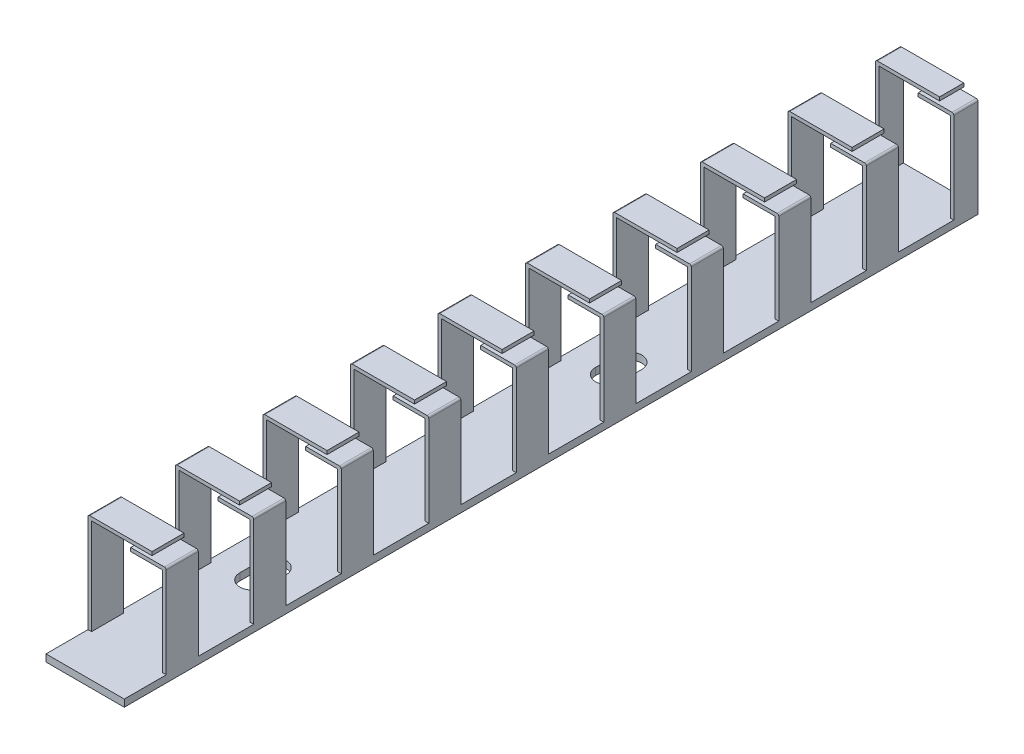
SolidWorks part; units mm, degrees
ref_plane "Plan de face" through (0, 0, 0) normal (0, 0, 1) x (1, 0, 0)
ref_plane "Plan de dessus" through (0, 0, 0) normal (0, 1, 0) x (1, 0, 0)
ref_plane "Plan de droite" through (0, 0, 0) normal (1, 0, 0) x (0, 0, -1)
sketch "Esquisse1" plane through (0, 0, 0) normal (0, 0, 1) x (1, 0, 0)
  line L0 (0, 0) -> (0, 14.75)
  line L1 (0.25, 15) -> (9, 15)
  line L2 (0, 0) -> (11, 0)
  line L3 (11, 0) -> (11, 13.75)
  line L4 (10.75, 14) -> (6, 14)
  line L5 (10.5, 13.5) -> (6, 13.5)
  line L6 (10.5, 1) -> (10.5, 13.5)
  line L7 (0.5, 1) -> (10.5, 1)
  line L8 (0.5, 1) -> (0.5, 14.5)
  line L9 (0.5, 14.5) -> (9, 14.5)
  line L10 (9, 15) -> (9, 14.5)
  line L11 (6, 14) -> (6, 13.5)
  line L12 (11, 0) -> (11, 14) construction
  line L13 (10.5, 0.5) -> (10.5, 13.5) construction
  line L14 (0.5, 0.5) -> (0.5, 14.5) construction
  line L15 (11, 14) -> (6, 14) construction
  line L16 (0, 0) -> (0, 15) construction
  line L17 (0, 15) -> (9, 15) construction
  line L24 (0.5, 0.5) -> (10.5, 0.5) construction
  arc A0 (11, 13.75) -> (10.75, 14) centre (10.75, 13.75) ccw
  arc A1 (0, 14.75) -> (0.25, 15) centre (0.25, 14.75) cw
  point P19 (11, 14)
  point P23 (0, 15)
  dimension "D5" = 0.25
  dimension "D1" = 11
  dimension "D2" = 15
  dimension "D3" = 14
  dimension "D4" = 1
extrude "Boss.-Extru.1" add sketch "Esquisse1" along normal blind 250
sketch "Esquisse2" plane through (11, 0, 0) normal (1, 0, 0) x (0, 0, -1)
  line L0 (-250, 0) -> (0, 0) construction
  line L1 (-128.9, 1) -> (-121.1, 1)
  line L2 (-128.9, 1) -> (-128.9, 17)
  line L3 (-128.9, 17) -> (-121.1, 17)
  line L4 (-121.1, 1) -> (-121.1, 17)
  line L5 (-116.6, 1) -> (-108.8, 1)
  line L6 (-116.6, 1) -> (-116.6, 17)
  line L7 (-116.6, 17) -> (-108.8, 17)
  line L8 (-108.8, 1) -> (-108.8, 17)
  line L9 (-104.3, 1) -> (-96.5, 1)
  line L10 (-104.3, 1) -> (-104.3, 17)
  line L11 (-104.3, 17) -> (-96.5, 17)
  line L12 (-96.5, 1) -> (-96.5, 17)
  line L13 (-92, 1) -> (-84.2, 1)
  line L14 (-92, 1) -> (-92, 17)
  line L15 (-92, 17) -> (-84.2, 17)
  line L16 (-84.2, 1) -> (-84.2, 17)
  line L17 (-79.7, 1) -> (-71.9, 1)
  line L18 (-79.7, 1) -> (-79.7, 17)
  line L19 (-79.7, 17) -> (-71.9, 17)
  line L20 (-71.9, 1) -> (-71.9, 17)
  line L21 (-67.4, 1) -> (-59.6, 1)
  line L22 (-67.4, 1) -> (-67.4, 17)
  line L23 (-67.4, 17) -> (-59.6, 17)
  line L24 (-59.6, 1) -> (-59.6, 17)
  line L25 (-55.1, 1) -> (-47.3, 1)
  line L26 (-55.1, 1) -> (-55.1, 17)
  line L27 (-55.1, 17) -> (-47.3, 17)
  line L28 (-47.3, 1) -> (-47.3, 17)
  line L29 (-42.8, 1) -> (-35, 1)
  line L30 (-42.8, 1) -> (-42.8, 17)
  line L31 (-42.8, 17) -> (-35, 17)
  line L32 (-35, 1) -> (-35, 17)
  line L33 (-30.5, 1) -> (-22.7, 1)
  line L34 (-30.5, 1) -> (-30.5, 17)
  line L35 (-30.5, 17) -> (-22.7, 17)
  line L36 (-22.7, 1) -> (-22.7, 17)
  line L37 (-18.2, 1) -> (-10.4, 1)
  line L38 (-18.2, 1) -> (-18.2, 17)
  line L39 (-18.2, 17) -> (-10.4, 17)
  line L40 (-10.4, 1) -> (-10.4, 17)
  line L41 (-5.9, 1) -> (1.9, 1)
  line L42 (-5.9, 1) -> (-5.9, 17)
  line L43 (-5.9, 17) -> (1.9, 17)
  line L44 (1.9, 1) -> (1.9, 17)
  line L45 (-128.9, 1) -> (-121.1, 1)
  line L46 (-128.9, 1) -> (-128.9, 17)
  line L47 (-128.9, 17) -> (-121.1, 17)
  line L48 (-121.1, 1) -> (-121.1, 17)
  line L49 (-116.6, 1) -> (-108.8, 1)
  line L50 (-116.6, 1) -> (-116.6, 17)
  line L51 (-116.6, 17) -> (-108.8, 17)
  line L52 (-108.8, 1) -> (-108.8, 17)
  line L53 (-104.3, 1) -> (-96.5, 1)
  line L54 (-104.3, 1) -> (-104.3, 17)
  line L55 (-104.3, 17) -> (-96.5, 17)
  line L56 (-96.5, 1) -> (-96.5, 17)
  line L57 (-92, 1) -> (-84.2, 1)
  line L58 (-92, 1) -> (-92, 17)
  line L59 (-92, 17) -> (-84.2, 17)
  line L60 (-84.2, 1) -> (-84.2, 17)
  line L61 (-79.7, 1) -> (-71.9, 1)
  line L62 (-79.7, 1) -> (-79.7, 17)
  line L63 (-79.7, 17) -> (-71.9, 17)
  line L64 (-71.9, 1) -> (-71.9, 17)
  line L65 (-67.4, 1) -> (-59.6, 1)
  line L66 (-67.4, 1) -> (-67.4, 17)
  line L67 (-67.4, 17) -> (-59.6, 17)
  line L68 (-59.6, 1) -> (-59.6, 17)
  line L69 (-55.1, 1) -> (-47.3, 1)
  line L70 (-55.1, 1) -> (-55.1, 17)
  line L71 (-55.1, 17) -> (-47.3, 17)
  line L72 (-47.3, 1) -> (-47.3, 17)
  line L73 (-42.8, 1) -> (-35, 1)
  line L74 (-42.8, 1) -> (-42.8, 17)
  line L75 (-42.8, 17) -> (-35, 17)
  line L76 (-35, 1) -> (-35, 17)
  line L77 (-30.5, 1) -> (-22.7, 1)
  line L78 (-30.5, 1) -> (-30.5, 17)
  line L79 (-30.5, 17) -> (-22.7, 17)
  line L80 (-22.7, 1) -> (-22.7, 17)
  line L81 (-18.2, 1) -> (-10.4, 1)
  line L82 (-18.2, 1) -> (-18.2, 17)
  line L83 (-18.2, 17) -> (-10.4, 17)
  line L84 (-10.4, 1) -> (-10.4, 17)
  line L85 (-141.2, 1) -> (-133.4, 1)
  line L86 (-141.2, 1) -> (-141.2, 17)
  line L87 (-141.2, 17) -> (-133.4, 17)
  line L88 (-133.4, 1) -> (-133.4, 17)
  line L89 (-128.9, 1) -> (-121.1, 1)
  line L90 (-128.9, 1) -> (-128.9, 17)
  line L91 (-128.9, 17) -> (-121.1, 17)
  line L92 (-121.1, 1) -> (-121.1, 17)
  line L93 (-116.6, 1) -> (-108.8, 1)
  line L94 (-116.6, 1) -> (-116.6, 17)
  line L95 (-116.6, 17) -> (-108.8, 17)
  line L96 (-108.8, 1) -> (-108.8, 17)
  line L97 (-104.3, 1) -> (-96.5, 1)
  line L98 (-104.3, 1) -> (-104.3, 17)
  line L99 (-104.3, 17) -> (-96.5, 17)
  line L100 (-96.5, 1) -> (-96.5, 17)
  line L101 (-92, 1) -> (-84.2, 1)
  line L102 (-92, 1) -> (-92, 17)
  line L103 (-92, 17) -> (-84.2, 17)
  line L104 (-84.2, 1) -> (-84.2, 17)
  line L105 (-79.7, 1) -> (-71.9, 1)
  line L106 (-79.7, 1) -> (-79.7, 17)
  line L107 (-79.7, 17) -> (-71.9, 17)
  line L108 (-71.9, 1) -> (-71.9, 17)
  line L109 (-67.4, 1) -> (-59.6, 1)
  line L110 (-67.4, 1) -> (-67.4, 17)
  line L111 (-67.4, 17) -> (-59.6, 17)
  line L112 (-59.6, 1) -> (-59.6, 17)
  line L113 (-55.1, 1) -> (-47.3, 1)
  line L114 (-55.1, 1) -> (-55.1, 17)
  line L115 (-55.1, 17) -> (-47.3, 17)
  line L116 (-47.3, 1) -> (-47.3, 17)
  line L117 (-42.8, 1) -> (-35, 1)
  line L118 (-42.8, 1) -> (-42.8, 17)
  line L119 (-42.8, 17) -> (-35, 17)
  line L120 (-35, 1) -> (-35, 17)
  line L121 (-30.5, 1) -> (-22.7, 1)
  line L122 (-30.5, 1) -> (-30.5, 17)
  line L123 (-30.5, 17) -> (-22.7, 17)
  line L124 (-22.7, 1) -> (-22.7, 17)
  line L125 (-153.5, 1) -> (-145.7, 1)
  line L126 (-153.5, 1) -> (-153.5, 17)
  line L127 (-153.5, 17) -> (-145.7, 17)
  line L128 (-145.7, 1) -> (-145.7, 17)
  line L129 (-141.2, 1) -> (-133.4, 1)
  line L130 (-141.2, 1) -> (-141.2, 17)
  line L131 (-141.2, 17) -> (-133.4, 17)
  line L132 (-133.4, 1) -> (-133.4, 17)
  line L133 (-128.9, 1) -> (-121.1, 1)
  line L134 (-128.9, 1) -> (-128.9, 17)
  line L135 (-128.9, 17) -> (-121.1, 17)
  line L136 (-121.1, 1) -> (-121.1, 17)
  line L137 (-116.6, 1) -> (-108.8, 1)
  line L138 (-116.6, 1) -> (-116.6, 17)
  line L139 (-116.6, 17) -> (-108.8, 17)
  line L140 (-108.8, 1) -> (-108.8, 17)
  line L141 (-104.3, 1) -> (-96.5, 1)
  line L142 (-104.3, 1) -> (-104.3, 17)
  line L143 (-104.3, 17) -> (-96.5, 17)
  line L144 (-96.5, 1) -> (-96.5, 17)
  line L145 (-92, 1) -> (-84.2, 1)
  line L146 (-92, 1) -> (-92, 17)
  line L147 (-92, 17) -> (-84.2, 17)
  line L148 (-84.2, 1) -> (-84.2, 17)
  line L149 (-79.7, 1) -> (-71.9, 1)
  line L150 (-79.7, 1) -> (-79.7, 17)
  line L151 (-79.7, 17) -> (-71.9, 17)
  line L152 (-71.9, 1) -> (-71.9, 17)
  line L153 (-67.4, 1) -> (-59.6, 1)
  line L154 (-67.4, 1) -> (-67.4, 17)
  line L155 (-67.4, 17) -> (-59.6, 17)
  line L156 (-59.6, 1) -> (-59.6, 17)
  line L157 (-55.1, 1) -> (-47.3, 1)
  line L158 (-55.1, 1) -> (-55.1, 17)
  line L159 (-55.1, 17) -> (-47.3, 17)
  line L160 (-47.3, 1) -> (-47.3, 17)
  line L161 (-42.8, 1) -> (-35, 1)
  line L162 (-42.8, 1) -> (-42.8, 17)
  line L163 (-42.8, 17) -> (-35, 17)
  line L164 (-35, 1) -> (-35, 17)
  line L165 (-165.8, 1) -> (-158, 1)
  line L166 (-165.8, 1) -> (-165.8, 17)
  line L167 (-165.8, 17) -> (-158, 17)
  line L168 (-158, 1) -> (-158, 17)
  line L169 (-153.5, 1) -> (-145.7, 1)
  line L170 (-153.5, 1) -> (-153.5, 17)
  line L171 (-153.5, 17) -> (-145.7, 17)
  line L172 (-145.7, 1) -> (-145.7, 17)
  line L173 (-141.2, 1) -> (-133.4, 1)
  line L174 (-141.2, 1) -> (-141.2, 17)
  line L175 (-141.2, 17) -> (-133.4, 17)
  line L176 (-133.4, 1) -> (-133.4, 17)
  line L177 (-128.9, 1) -> (-121.1, 1)
  line L178 (-128.9, 1) -> (-128.9, 17)
  line L179 (-128.9, 17) -> (-121.1, 17)
  line L180 (-121.1, 1) -> (-121.1, 17)
  line L181 (-116.6, 1) -> (-108.8, 1)
  line L182 (-116.6, 1) -> (-116.6, 17)
  line L183 (-116.6, 17) -> (-108.8, 17)
  line L184 (-108.8, 1) -> (-108.8, 17)
  line L185 (-104.3, 1) -> (-96.5, 1)
  line L186 (-104.3, 1) -> (-104.3, 17)
  line L187 (-104.3, 17) -> (-96.5, 17)
  line L188 (-96.5, 1) -> (-96.5, 17)
  line L189 (-92, 1) -> (-84.2, 1)
  line L190 (-92, 1) -> (-92, 17)
  line L191 (-92, 17) -> (-84.2, 17)
  line L192 (-84.2, 1) -> (-84.2, 17)
  line L193 (-79.7, 1) -> (-71.9, 1)
  line L194 (-79.7, 1) -> (-79.7, 17)
  line L195 (-79.7, 17) -> (-71.9, 17)
  line L196 (-71.9, 1) -> (-71.9, 17)
  line L197 (-67.4, 1) -> (-59.6, 1)
  line L198 (-67.4, 1) -> (-67.4, 17)
  line L199 (-67.4, 17) -> (-59.6, 17)
  line L200 (-59.6, 1) -> (-59.6, 17)
  line L201 (-55.1, 1) -> (-47.3, 1)
  line L202 (-55.1, 1) -> (-55.1, 17)
  line L203 (-55.1, 17) -> (-47.3, 17)
  line L204 (-47.3, 1) -> (-47.3, 17)
  line L205 (-178.1, 1) -> (-170.3, 1)
  line L206 (-178.1, 1) -> (-178.1, 17)
  line L207 (-178.1, 17) -> (-170.3, 17)
  line L208 (-170.3, 1) -> (-170.3, 17)
  line L209 (-165.8, 1) -> (-158, 1)
  line L210 (-165.8, 1) -> (-165.8, 17)
  line L211 (-165.8, 17) -> (-158, 17)
  line L212 (-158, 1) -> (-158, 17)
  line L213 (-153.5, 1) -> (-145.7, 1)
  line L214 (-153.5, 1) -> (-153.5, 17)
  line L215 (-153.5, 17) -> (-145.7, 17)
  line L216 (-145.7, 1) -> (-145.7, 17)
  line L217 (-141.2, 1) -> (-133.4, 1)
  line L218 (-141.2, 1) -> (-141.2, 17)
  line L219 (-141.2, 17) -> (-133.4, 17)
  line L220 (-133.4, 1) -> (-133.4, 17)
  line L221 (-128.9, 1) -> (-121.1, 1)
  line L222 (-128.9, 1) -> (-128.9, 17)
  line L223 (-128.9, 17) -> (-121.1, 17)
  line L224 (-121.1, 1) -> (-121.1, 17)
  line L225 (-116.6, 1) -> (-108.8, 1)
  line L226 (-116.6, 1) -> (-116.6, 17)
  line L227 (-116.6, 17) -> (-108.8, 17)
  line L228 (-108.8, 1) -> (-108.8, 17)
  line L229 (-104.3, 1) -> (-96.5, 1)
  line L230 (-104.3, 1) -> (-104.3, 17)
  line L231 (-104.3, 17) -> (-96.5, 17)
  line L232 (-96.5, 1) -> (-96.5, 17)
  line L233 (-92, 1) -> (-84.2, 1)
  line L234 (-92, 1) -> (-92, 17)
  line L235 (-92, 17) -> (-84.2, 17)
  line L236 (-84.2, 1) -> (-84.2, 17)
  line L237 (-79.7, 1) -> (-71.9, 1)
  line L238 (-79.7, 1) -> (-79.7, 17)
  line L239 (-79.7, 17) -> (-71.9, 17)
  line L240 (-71.9, 1) -> (-71.9, 17)
  line L241 (-67.4, 1) -> (-59.6, 1)
  line L242 (-67.4, 1) -> (-67.4, 17)
  line L243 (-67.4, 17) -> (-59.6, 17)
  line L244 (-59.6, 1) -> (-59.6, 17)
  line L245 (-190.4, 1) -> (-182.6, 1)
  line L246 (-190.4, 1) -> (-190.4, 17)
  line L247 (-190.4, 17) -> (-182.6, 17)
  line L248 (-182.6, 1) -> (-182.6, 17)
  line L249 (-178.1, 1) -> (-170.3, 1)
  line L250 (-178.1, 1) -> (-178.1, 17)
  line L251 (-178.1, 17) -> (-170.3, 17)
  line L252 (-170.3, 1) -> (-170.3, 17)
  line L253 (-165.8, 1) -> (-158, 1)
  line L254 (-165.8, 1) -> (-165.8, 17)
  line L255 (-165.8, 17) -> (-158, 17)
  line L256 (-158, 1) -> (-158, 17)
  line L257 (-153.5, 1) -> (-145.7, 1)
  line L258 (-153.5, 1) -> (-153.5, 17)
  line L259 (-153.5, 17) -> (-145.7, 17)
  line L260 (-145.7, 1) -> (-145.7, 17)
  line L261 (-141.2, 1) -> (-133.4, 1)
  line L262 (-141.2, 1) -> (-141.2, 17)
  line L263 (-141.2, 17) -> (-133.4, 17)
  line L264 (-133.4, 1) -> (-133.4, 17)
  line L265 (-128.9, 1) -> (-121.1, 1)
  line L266 (-128.9, 1) -> (-128.9, 17)
  line L267 (-128.9, 17) -> (-121.1, 17)
  line L268 (-121.1, 1) -> (-121.1, 17)
  line L269 (-116.6, 1) -> (-108.8, 1)
  line L270 (-116.6, 1) -> (-116.6, 17)
  line L271 (-116.6, 17) -> (-108.8, 17)
  line L272 (-108.8, 1) -> (-108.8, 17)
  line L273 (-104.3, 1) -> (-96.5, 1)
  line L274 (-104.3, 1) -> (-104.3, 17)
  line L275 (-104.3, 17) -> (-96.5, 17)
  line L276 (-96.5, 1) -> (-96.5, 17)
  line L277 (-92, 1) -> (-84.2, 1)
  line L278 (-92, 1) -> (-92, 17)
  line L279 (-92, 17) -> (-84.2, 17)
  line L280 (-84.2, 1) -> (-84.2, 17)
  line L281 (-79.7, 1) -> (-71.9, 1)
  line L282 (-79.7, 1) -> (-79.7, 17)
  line L283 (-79.7, 17) -> (-71.9, 17)
  line L284 (-71.9, 1) -> (-71.9, 17)
  line L285 (-202.7, 1) -> (-194.9, 1)
  line L286 (-202.7, 1) -> (-202.7, 17)
  line L287 (-202.7, 17) -> (-194.9, 17)
  line L288 (-194.9, 1) -> (-194.9, 17)
  line L289 (-190.4, 1) -> (-182.6, 1)
  line L290 (-190.4, 1) -> (-190.4, 17)
  line L291 (-190.4, 17) -> (-182.6, 17)
  line L292 (-182.6, 1) -> (-182.6, 17)
  line L293 (-178.1, 1) -> (-170.3, 1)
  line L294 (-178.1, 1) -> (-178.1, 17)
  line L295 (-178.1, 17) -> (-170.3, 17)
  line L296 (-170.3, 1) -> (-170.3, 17)
  line L297 (-165.8, 1) -> (-158, 1)
  line L298 (-165.8, 1) -> (-165.8, 17)
  line L299 (-165.8, 17) -> (-158, 17)
  line L300 (-158, 1) -> (-158, 17)
  line L301 (-153.5, 1) -> (-145.7, 1)
  line L302 (-153.5, 1) -> (-153.5, 17)
  line L303 (-153.5, 17) -> (-145.7, 17)
  line L304 (-145.7, 1) -> (-145.7, 17)
  line L305 (-141.2, 1) -> (-133.4, 1)
  line L306 (-141.2, 1) -> (-141.2, 17)
  line L307 (-141.2, 17) -> (-133.4, 17)
  line L308 (-133.4, 1) -> (-133.4, 17)
  line L309 (-128.9, 1) -> (-121.1, 1)
  line L310 (-128.9, 1) -> (-128.9, 17)
  line L311 (-128.9, 17) -> (-121.1, 17)
  line L312 (-121.1, 1) -> (-121.1, 17)
  line L313 (-116.6, 1) -> (-108.8, 1)
  line L314 (-116.6, 1) -> (-116.6, 17)
  line L315 (-116.6, 17) -> (-108.8, 17)
  line L316 (-108.8, 1) -> (-108.8, 17)
  line L317 (-104.3, 1) -> (-96.5, 1)
  line L318 (-104.3, 1) -> (-104.3, 17)
  line L319 (-104.3, 17) -> (-96.5, 17)
  line L320 (-96.5, 1) -> (-96.5, 17)
  line L321 (-92, 1) -> (-84.2, 1)
  line L322 (-92, 1) -> (-92, 17)
  line L323 (-92, 17) -> (-84.2, 17)
  line L324 (-84.2, 1) -> (-84.2, 17)
  line L325 (-215, 1) -> (-207.2, 1)
  line L326 (-215, 1) -> (-215, 17)
  line L327 (-215, 17) -> (-207.2, 17)
  line L328 (-207.2, 1) -> (-207.2, 17)
  line L329 (-202.7, 1) -> (-194.9, 1)
  line L330 (-202.7, 1) -> (-202.7, 17)
  line L331 (-202.7, 17) -> (-194.9, 17)
  line L332 (-194.9, 1) -> (-194.9, 17)
  line L333 (-190.4, 1) -> (-182.6, 1)
  line L334 (-190.4, 1) -> (-190.4, 17)
  line L335 (-190.4, 17) -> (-182.6, 17)
  line L336 (-182.6, 1) -> (-182.6, 17)
  line L337 (-178.1, 1) -> (-170.3, 1)
  line L338 (-178.1, 1) -> (-178.1, 17)
  line L339 (-178.1, 17) -> (-170.3, 17)
  line L340 (-170.3, 1) -> (-170.3, 17)
  line L341 (-165.8, 1) -> (-158, 1)
  line L342 (-165.8, 1) -> (-165.8, 17)
  line L343 (-165.8, 17) -> (-158, 17)
  line L344 (-158, 1) -> (-158, 17)
  line L345 (-153.5, 1) -> (-145.7, 1)
  line L346 (-153.5, 1) -> (-153.5, 17)
  line L347 (-153.5, 17) -> (-145.7, 17)
  line L348 (-145.7, 1) -> (-145.7, 17)
  line L349 (-141.2, 1) -> (-133.4, 1)
  line L350 (-141.2, 1) -> (-141.2, 17)
  line L351 (-141.2, 17) -> (-133.4, 17)
  line L352 (-133.4, 1) -> (-133.4, 17)
  line L353 (-128.9, 1) -> (-121.1, 1)
  line L354 (-128.9, 1) -> (-128.9, 17)
  line L355 (-128.9, 17) -> (-121.1, 17)
  line L356 (-121.1, 1) -> (-121.1, 17)
  line L357 (-116.6, 1) -> (-108.8, 1)
  line L358 (-116.6, 1) -> (-116.6, 17)
  line L359 (-116.6, 17) -> (-108.8, 17)
  line L360 (-108.8, 1) -> (-108.8, 17)
  line L361 (-104.3, 1) -> (-96.5, 1)
  line L362 (-104.3, 1) -> (-104.3, 17)
  line L363 (-104.3, 17) -> (-96.5, 17)
  line L364 (-96.5, 1) -> (-96.5, 17)
  line L365 (-227.3, 1) -> (-219.5, 1)
  line L366 (-227.3, 1) -> (-227.3, 17)
  line L367 (-227.3, 17) -> (-219.5, 17)
  line L368 (-219.5, 1) -> (-219.5, 17)
  line L369 (-215, 1) -> (-207.2, 1)
  line L370 (-215, 1) -> (-215, 17)
  line L371 (-215, 17) -> (-207.2, 17)
  line L372 (-207.2, 1) -> (-207.2, 17)
  line L373 (-202.7, 1) -> (-194.9, 1)
  line L374 (-202.7, 1) -> (-202.7, 17)
  line L375 (-202.7, 17) -> (-194.9, 17)
  line L376 (-194.9, 1) -> (-194.9, 17)
  line L377 (-190.4, 1) -> (-182.6, 1)
  line L378 (-190.4, 1) -> (-190.4, 17)
  line L379 (-190.4, 17) -> (-182.6, 17)
  line L380 (-182.6, 1) -> (-182.6, 17)
  line L381 (-178.1, 1) -> (-170.3, 1)
  line L382 (-178.1, 1) -> (-178.1, 17)
  line L383 (-178.1, 17) -> (-170.3, 17)
  line L384 (-170.3, 1) -> (-170.3, 17)
  line L385 (-165.8, 1) -> (-158, 1)
  line L386 (-165.8, 1) -> (-165.8, 17)
  line L387 (-165.8, 17) -> (-158, 17)
  line L388 (-158, 1) -> (-158, 17)
  line L389 (-153.5, 1) -> (-145.7, 1)
  line L390 (-153.5, 1) -> (-153.5, 17)
  line L391 (-153.5, 17) -> (-145.7, 17)
  line L392 (-145.7, 1) -> (-145.7, 17)
  line L393 (-141.2, 1) -> (-133.4, 1)
  line L394 (-141.2, 1) -> (-141.2, 17)
  line L395 (-141.2, 17) -> (-133.4, 17)
  line L396 (-133.4, 1) -> (-133.4, 17)
  line L397 (-128.9, 1) -> (-121.1, 1)
  line L398 (-128.9, 1) -> (-128.9, 17)
  line L399 (-128.9, 17) -> (-121.1, 17)
  line L400 (-121.1, 1) -> (-121.1, 17)
  line L401 (-116.6, 1) -> (-108.8, 1)
  line L402 (-116.6, 1) -> (-116.6, 17)
  line L403 (-116.6, 17) -> (-108.8, 17)
  line L404 (-108.8, 1) -> (-108.8, 17)
  line L405 (-239.6, 1) -> (-231.8, 1)
  line L406 (-239.6, 1) -> (-239.6, 17)
  line L407 (-239.6, 17) -> (-231.8, 17)
  line L408 (-231.8, 1) -> (-231.8, 17)
  line L409 (-227.3, 1) -> (-219.5, 1)
  line L410 (-227.3, 1) -> (-227.3, 17)
  line L411 (-227.3, 17) -> (-219.5, 17)
  line L412 (-219.5, 1) -> (-219.5, 17)
  line L413 (-215, 1) -> (-207.2, 1)
  line L414 (-215, 1) -> (-215, 17)
  line L415 (-215, 17) -> (-207.2, 17)
  line L416 (-207.2, 1) -> (-207.2, 17)
  line L417 (-202.7, 1) -> (-194.9, 1)
  line L418 (-202.7, 1) -> (-202.7, 17)
  line L419 (-202.7, 17) -> (-194.9, 17)
  line L420 (-194.9, 1) -> (-194.9, 17)
  line L421 (-190.4, 1) -> (-182.6, 1)
  line L422 (-190.4, 1) -> (-190.4, 17)
  line L423 (-190.4, 17) -> (-182.6, 17)
  line L424 (-182.6, 1) -> (-182.6, 17)
  line L425 (-178.1, 1) -> (-170.3, 1)
  line L426 (-178.1, 1) -> (-178.1, 17)
  line L427 (-178.1, 17) -> (-170.3, 17)
  line L428 (-170.3, 1) -> (-170.3, 17)
  line L429 (-165.8, 1) -> (-158, 1)
  line L430 (-165.8, 1) -> (-165.8, 17)
  line L431 (-165.8, 17) -> (-158, 17)
  line L432 (-158, 1) -> (-158, 17)
  line L433 (-153.5, 1) -> (-145.7, 1)
  line L434 (-153.5, 1) -> (-153.5, 17)
  line L435 (-153.5, 17) -> (-145.7, 17)
  line L436 (-145.7, 1) -> (-145.7, 17)
  line L437 (-141.2, 1) -> (-133.4, 1)
  line L438 (-141.2, 1) -> (-141.2, 17)
  line L439 (-141.2, 17) -> (-133.4, 17)
  line L440 (-133.4, 1) -> (-133.4, 17)
  line L441 (-128.9, 1) -> (-121.1, 1)
  line L442 (-128.9, 1) -> (-128.9, 17)
  line L443 (-128.9, 17) -> (-121.1, 17)
  line L444 (-121.1, 1) -> (-121.1, 17)
  line L445 (-141.2, 1) -> (-133.4, 1)
  line L446 (-141.2, 1) -> (-141.2, 17)
  line L447 (-141.2, 17) -> (-133.4, 17)
  line L448 (-133.4, 1) -> (-133.4, 17)
  line L449 (-153.5, 1) -> (-145.7, 1)
  line L450 (-153.5, 1) -> (-153.5, 17)
  line L451 (-153.5, 17) -> (-145.7, 17)
  line L452 (-145.7, 1) -> (-145.7, 17)
  line L453 (-165.8, 1) -> (-158, 1)
  line L454 (-165.8, 1) -> (-165.8, 17)
  line L455 (-165.8, 17) -> (-158, 17)
  line L456 (-158, 1) -> (-158, 17)
  line L457 (-178.1, 1) -> (-170.3, 1)
  line L458 (-178.1, 1) -> (-178.1, 17)
  line L459 (-178.1, 17) -> (-170.3, 17)
  line L460 (-170.3, 1) -> (-170.3, 17)
  line L461 (-190.4, 1) -> (-182.6, 1)
  line L462 (-190.4, 1) -> (-190.4, 17)
  line L463 (-190.4, 17) -> (-182.6, 17)
  line L464 (-182.6, 1) -> (-182.6, 17)
  line L465 (-202.7, 1) -> (-194.9, 1)
  line L466 (-202.7, 1) -> (-202.7, 17)
  line L467 (-202.7, 17) -> (-194.9, 17)
  line L468 (-194.9, 1) -> (-194.9, 17)
  line L469 (-215, 1) -> (-207.2, 1)
  line L470 (-215, 1) -> (-215, 17)
  line L471 (-215, 17) -> (-207.2, 17)
  line L472 (-207.2, 1) -> (-207.2, 17)
  line L473 (-227.3, 1) -> (-219.5, 1)
  line L474 (-227.3, 1) -> (-227.3, 17)
  line L475 (-227.3, 17) -> (-219.5, 17)
  line L476 (-219.5, 1) -> (-219.5, 17)
  line L477 (-239.6, 1) -> (-231.8, 1)
  line L478 (-239.6, 1) -> (-239.6, 17)
  line L479 (-239.6, 17) -> (-231.8, 17)
  line L480 (-231.8, 1) -> (-231.8, 17)
  line L481 (-251.9, 1) -> (-244.1, 1)
  line L482 (-251.9, 1) -> (-251.9, 17)
  line L483 (-251.9, 17) -> (-244.1, 17)
  line L484 (-244.1, 1) -> (-244.1, 17)
  point P7 (-125, 0)
  dimension "D1" = 3.9
  dimension "D2" = 11
extrude "Enlèv. mat.-Extru.1" cut sketch "Esquisse2" against normal through all
sketch "Esquisse4" plane through (0, 0, 0) normal (0, -1, 0) x (1, 0, 0)
  line L0 (5.5, 250) -> (5.5, 0) construction
  line L1 (0, 250) -> (11, 250) construction
  line L2 (0, 0) -> (11, 0) construction
  line L3 (5.5, 226.5) -> (5.5, 223.5) construction
  line L4 (7.25, 226.5) -> (7.25, 223.5)
  line L5 (3.75, 226.5) -> (3.75, 223.5)
  line L6 (5.5, 176.5) -> (5.5, 173.5) construction
  line L7 (7.25, 176.5) -> (7.25, 173.5)
  line L8 (3.75, 176.5) -> (3.75, 173.5)
  line L9 (5.5, 126.5) -> (5.5, 123.5) construction
  line L10 (7.25, 126.5) -> (7.25, 123.5)
  line L11 (3.75, 126.5) -> (3.75, 123.5)
  line L12 (5.5, 76.5) -> (5.5, 73.5) construction
  line L13 (7.25, 76.5) -> (7.25, 73.5)
  line L14 (3.75, 76.5) -> (3.75, 73.5)
  line L15 (5.5, 26.5) -> (5.5, 23.5) construction
  line L16 (7.25, 26.5) -> (7.25, 23.5)
  line L17 (3.75, 26.5) -> (3.75, 23.5)
  line L18 (5.5, 226.5) -> (5.5, 176.5) construction
  arc A0 (7.25, 226.5) -> (3.75, 226.5) centre (5.5, 226.5) ccw
  arc A1 (3.75, 223.5) -> (7.25, 223.5) centre (5.5, 223.5) ccw
  arc A2 (7.25, 176.5) -> (3.75, 176.5) centre (5.5, 176.5) ccw
  arc A3 (3.75, 173.5) -> (7.25, 173.5) centre (5.5, 173.5) ccw
  arc A4 (7.25, 126.5) -> (3.75, 126.5) centre (5.5, 126.5) ccw
  arc A5 (3.75, 123.5) -> (7.25, 123.5) centre (5.5, 123.5) ccw
  arc A6 (7.25, 76.5) -> (3.75, 76.5) centre (5.5, 76.5) ccw
  arc A7 (3.75, 73.5) -> (7.25, 73.5) centre (5.5, 73.5) ccw
  arc A8 (7.25, 26.5) -> (3.75, 26.5) centre (5.5, 26.5) ccw
  arc A9 (3.75, 23.5) -> (7.25, 23.5) centre (5.5, 23.5) ccw
  point P8 (5.5, 225)
  point P15 (5.5, 175)
  point P16 (5.5, 75)
  point P17 (5.5, 225)
  point P18 (5.5, 25)
  point P20 (5.5, 25)
  point P21 (5.5, 175)
  point P22 (5.5, 75)
  point P25 (5.5, 75)
  point P28 (5.5, 75)
  point P31 (5.5, 75)
  point P32 (5.5, 125)
  point P39 (5.5, 75)
  point P42 (5.5, 175)
  point P46 (5.5, 175)
  point P48 (5.5, 25)
  point P50 (5.5, 175)
  point P55 (5.5, 175)
  point P60 (5.5, 225)
  point P65 (5.5, 225)
  point P67 (5.5, 75)
  point P72 (5.5, 25)
  point P78 (5.5, 25)
  point P80 (5.5, 175)
  point P85 (5.5, 75)
  point P92 (5.5, 175)
  point P99 (5.5, 225)
  point P106 (5.5, 75)
  point P113 (5.5, 175)
  point P120 (5.5, 25)
  point P127 (5.5, 75)
  point P134 (5.5, 175)
  point P141 (5.5, 225)
  point P148 (5.5, 75)
  point P155 (5.5, 175)
  dimension "D1" = 25
  dimension "D2" = 3
  dimension "D4" = 5
  dimension "D3" = 1.75
  dimension "D5" = 50
extrude "Enlèv. mat.-Extru.2" cut sketch "Esquisse4" against normal up to next
sketch "Esquisse5" plane through (0, 0, 0) normal (0, -1, 0) x (-1, 0, 0)
  line L0 (-11, -250) -> (-11, 0) construction
  line L1 (0, 0) -> (-11, 0)
  line L2 (0, 0) -> (0, -130)
  line L3 (0, -130) -> (-11, -130)
  line L4 (-11, 0) -> (-11, -130)
  line L5 (0, -250) -> (-11, -250) construction
  dimension "D1" = 120
extrude "Enlèv. mat.-Extru.3" cut sketch "Esquisse5" against normal through all
